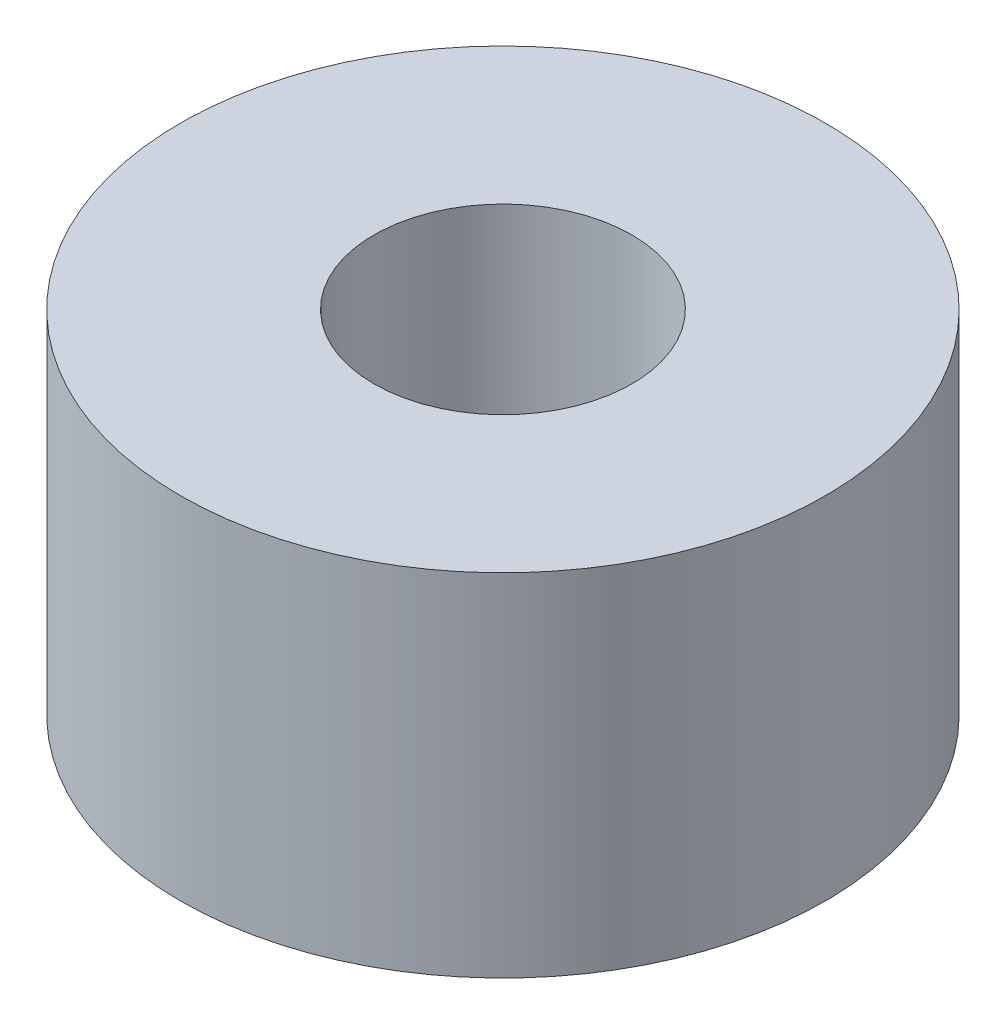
SolidWorks part; units mm, degrees
ref_plane "Front Plane" through (0, 0, 0) normal (0, 0, 1) x (1, 0, 0)
ref_plane "Top Plane" through (0, 0, 0) normal (0, 1, 0) x (1, 0, 0)
ref_plane "Right Plane" through (0, 0, 0) normal (1, 0, 0) x (0, 0, -1)
sketch "Sketch1" plane through (0, 0, 0) normal (0, 1, 0) x (1, 0, 0)
  circle A0 centre (0, 0) radius 3.175
  circle A1 centre (0, 0) radius 7.9375
  dimension "D1" = 15.875
  dimension "D2" = 6.35
extrude "Boss-Extrude1" add sketch "Sketch1" along normal blind 8.636
